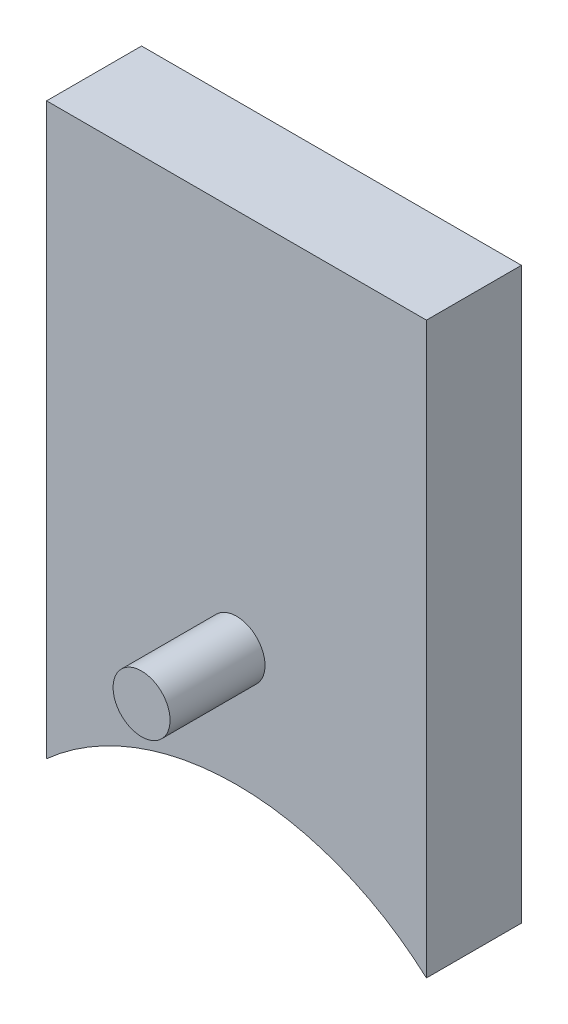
SolidWorks part; units mm, degrees
ref_plane "Front Plane" through (0, 0, 0) normal (0, 0, 1) x (1, 0, 0)
ref_plane "Top Plane" through (0, 0, 0) normal (0, 1, 0) x (1, 0, 0)
ref_plane "Right Plane" through (0, 0, 0) normal (1, 0, 0) x (0, 0, -1)
sketch "Sketch1" plane through (0, 0, 0) normal (0, 0, 1) x (1, 0, 0)
sketch_block_instance "Block-Slider-1"
sketch_block "Block-Slider" parameters "D3"=15, "D4"=3, "D1"=20, "D2"=30
extrude "Boss-Extrude1" add sketch "Sketch1" against normal blind 5
extrude "Boss-Extrude2" add sketch "Sketch1<2>" along normal blind 5 separate body
sketch "Sketch1<2>"
